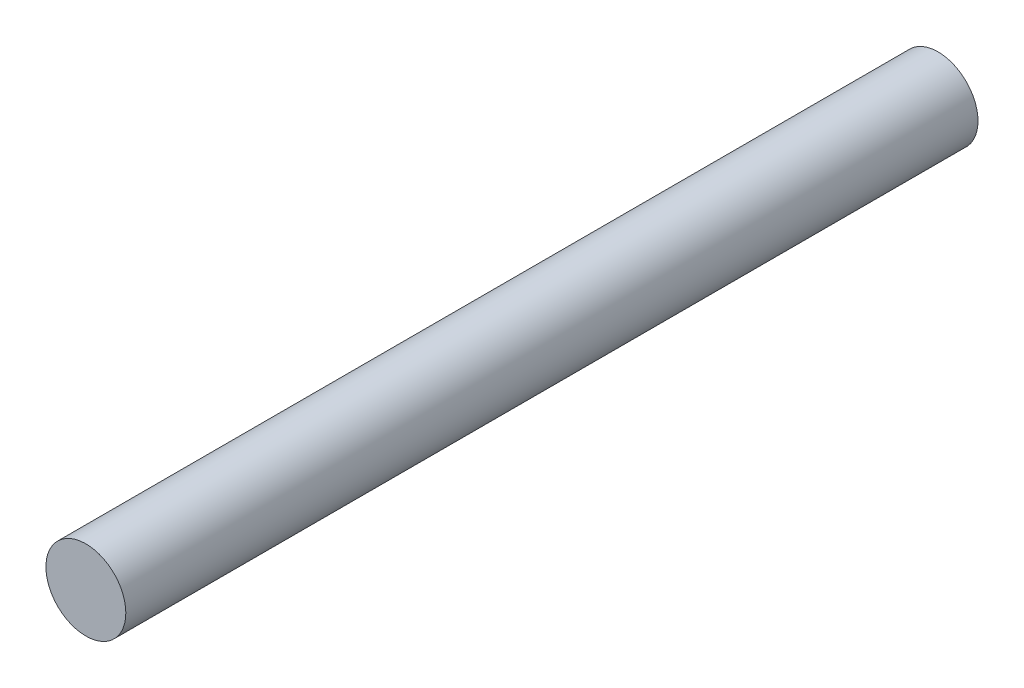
SolidWorks part; units mm, degrees
ref_plane "Front" through (0, 0, 0) normal (0, 0, 1) x (1, 0, 0)
ref_plane "Top" through (0, 0, 0) normal (0, 1, 0) x (1, 0, 0)
ref_plane "Right" through (0, 0, 0) normal (1, 0, 0) x (0, 0, -1)
sketch "Sketch1" plane through (0, 0, 0) normal (0, 0, 1) x (1, 0, 0)
  circle A0 centre (0, 0) radius 2.3812
  dimension "D1" = 4.7625
extrude "Extrude1" add sketch "Sketch1" along normal blind 50.8
